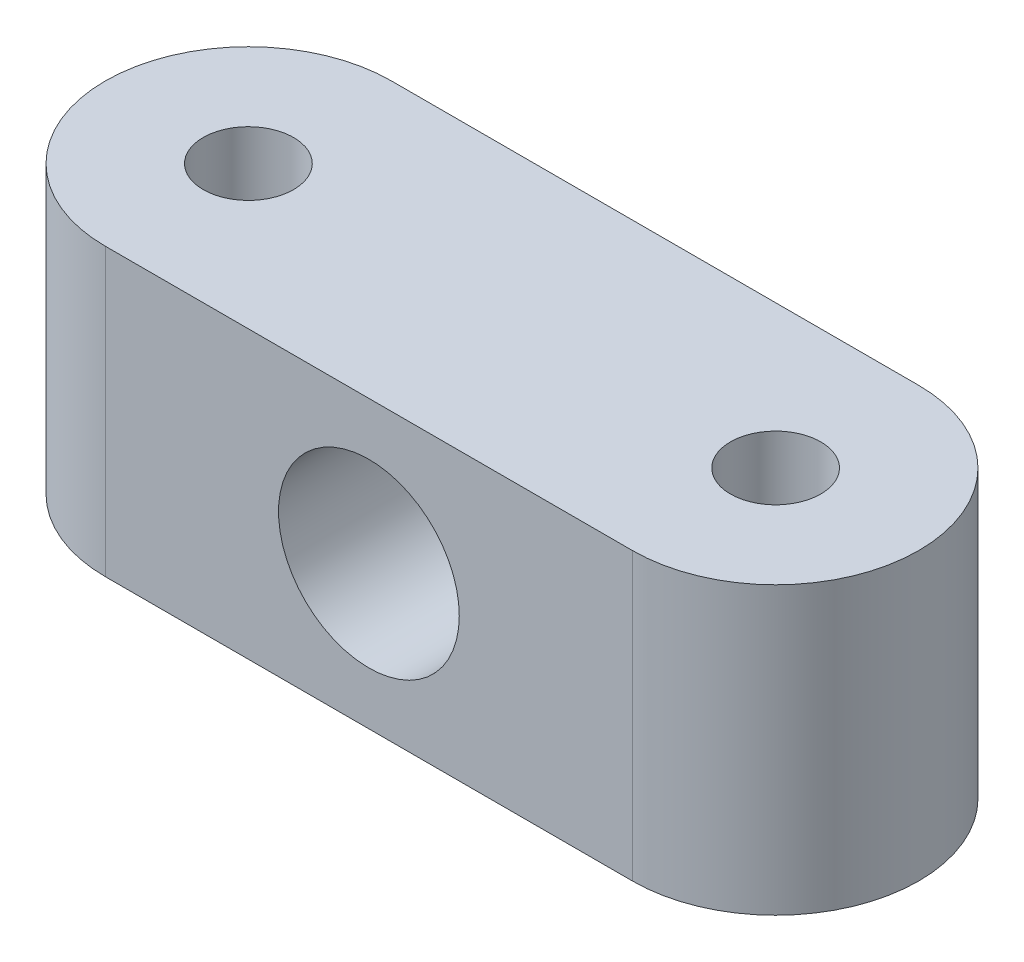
SolidWorks part; units mm, degrees
ref_plane "Front Plane" through (0, 0, 0) normal (0, 0, 1) x (1, 0, 0)
ref_plane "Top Plane" through (0, 0, 0) normal (0, 1, 0) x (1, 0, 0)
ref_plane "Right Plane" through (0, 0, 0) normal (1, 0, 0) x (0, 0, -1)
sketch "Sketch1" plane through (0, 0, 0) normal (0, 1, 0) x (1, 0, 0)
  line L0 (0, 0) -> (70, 0) construction
  line L1 (0, 19) -> (70, 19)
  line L2 (0, -19) -> (70, -19)
  arc A0 (0, 19) -> (0, -19) centre (0, 0) ccw
  arc A1 (70, -19) -> (70, 19) centre (70, 0) ccw
  circle A2 centre (0, 0) radius 6
  circle A3 centre (70, 0) radius 6
  point P3 (35, 0)
  dimension "D2" = 19
  dimension "D3" = 12
  dimension "D1" = 70
extrude "Boss-Extrude1" add sketch "Sketch1" along normal blind 38
sketch "Sketch2" plane through (0, 0, 19) normal (0, 0, 1) x (1, 0, 0)
  line L0 (35, 38) -> (35, 0) construction
  line L1 (0, 38) -> (70, 38) construction
  line L2 (0, 0) -> (70, 0) construction
  circle A0 centre (35, 19) radius 12
  dimension "D1" = 24
extrude "Cut-Extrude1" cut sketch "Sketch2" against normal through all both
